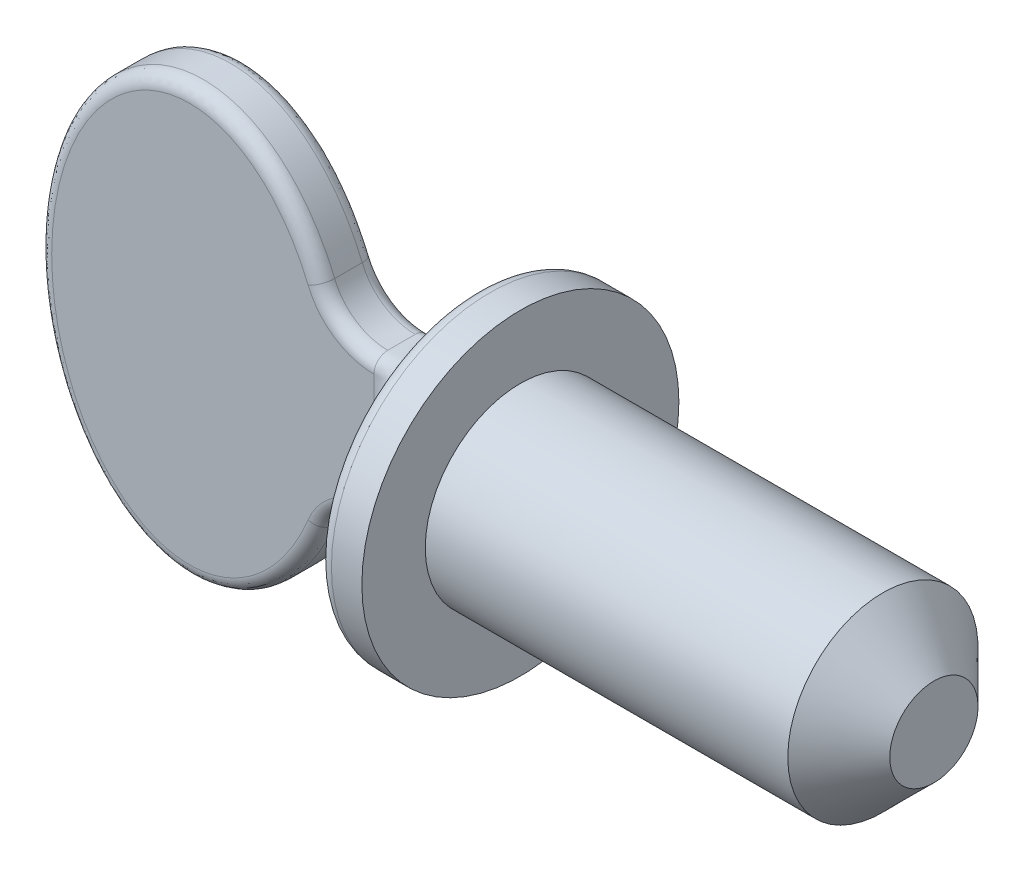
SolidWorks part; units mm, degrees
ref_plane "Front Plane" through (0, 0, 0) normal (0, 0, 1) x (1, 0, 0)
ref_plane "Top Plane" through (0, 0, 0) normal (0, 1, 0) x (1, 0, 0)
ref_plane "Right Plane" through (0, 0, 0) normal (1, 0, 0) x (0, 0, -1)
sketch "layout" plane through (0, 0, 0) normal (0, 0, 1) x (1, 0, 0)
  line L0 (0, 0) -> (13.208, 0) construction
  line L1 (5.588, 2.921) -> (5.588, -2.921)
  line L2 (3.3976, 1.3123) -> (4.8921, 1.3123) construction
  line L3 (5.588, 2.921) -> (4.7897, 2.921)
  line L4 (4.7897, 2.921) -> (4.7897, 3.2655) construction
  line L5 (4.2865, 1.706) -> (4.2865, 0)
  line L6 (4.2865, 1.706) -> (3.3355, 0.7551) construction
  line L7 (13.208, 1.7526) -> (13.208, 0)
  line L8 (3.3976, 1.3123) -> (3.3976, -1.3123)
  line L9 (13.208, 1.7526) -> (5.588, 1.7526)
  arc A0 (3.3976, 1.3123) -> (2.4197, 1.9685) centre (3.3976, 2.3692) cw
  arc A1 (4.7897, 2.921) -> (4.2865, 1.706) centre (3.0715, 2.921) cw
  arc A2 (3.3976, -1.3123) -> (2.4197, -1.9685) centre (3.3976, -2.3692) ccw
  ellipse E0 centre (0, 0) end of major axis (0, 3.937) minor radius 2.794 (2.4197, 1.9685) -> (2.4197, -1.9685) ccw
  dimension "Head Width" = 7.874
  dimension "Shoulder Dia" = 5.842
  dimension "Head Height" = 8.382
  dimension "D4" = 5.588
  dimension "D5" = 2.6247
  dimension "D6" = 3.937
  dimension "D7" = 3.4121
  dimension "D8" = 0.7983
  dimension "D9" = 45
  dimension "Length" = 7.62
  dimension "Base Screw Dia" = 3.5052
sketch "Sketch3" plane through (0, 0, 0) normal (0, 0, 1) x (1, 0, 0)
  line L0 (3.3976, 1.3123) -> (3.3976, -1.3123) construction
  line L1 (3.3976, 1.3123) -> (3.3976, -1.3123)
  arc A0 (3.3976, -1.3123) -> (2.4197, -1.9685) centre (3.3976, -2.3692) ccw construction
  arc A1 (2.4197, 1.9685) -> (3.3976, 1.3123) centre (3.3976, 2.3692) ccw construction
  arc A2 (3.3976, -1.3123) -> (2.4197, -1.9685) centre (3.3976, -2.3692) ccw
  arc A3 (2.4197, 1.9685) -> (3.3976, 1.3123) centre (3.3976, 2.3692) ccw
  ellipse E0 centre (0, 0) end of major axis (0, 3.937) minor radius 2.794 (2.4197, 1.9685) -> (2.4197, -1.9685) ccw construction
  ellipse E1 centre (0, 0) end of major axis (0, 3.937) minor radius 2.794 (2.4197, 1.9685) -> (2.4197, -1.9685) ccw
extrude "Extrude1" add sketch "Sketch3" along normal mid plane 1.016
fillet "Fillet1" radius 0.254 6 edges at (2.8088, 1.4916, -0.508) (2.8088, -1.4916, -0.508) (2.8088, 1.4916, 0.508) (2.8088, -1.4916, 0.508) (-2.794, 0, -0.508) (-2.794, 0, 0.508)
sketch "Sketch4" plane through (0, 0, 0) normal (0, 0, 1) x (1, 0, 0)
  line L0 (13.208, 1.7526) -> (13.208, 0) construction
  line L1 (13.208, 1.7526) -> (5.588, 1.7526) construction
  line L2 (5.588, 2.921) -> (5.588, -2.921) construction
  line L3 (5.588, 2.921) -> (4.7897, 2.921) construction
  line L4 (4.2865, 1.706) -> (4.2865, 0) construction
  line L5 (13.208, 0.8128) -> (13.208, 0)
  line L6 (12.2682, 1.7526) -> (5.588, 1.7526)
  line L7 (5.588, 2.921) -> (5.588, 1.7526)
  line L8 (5.588, 2.921) -> (4.7897, 2.921)
  line L9 (4.2865, 1.706) -> (4.2865, 0)
  line L10 (0, 0) -> (16.8942, 0) construction
  line L11 (13.208, 0) -> (4.2865, 0)
  line L12 (12.2682, 1.7526) -> (13.208, 0.8128)
  line L15 (12.2682, -1.7526) -> (13.208, -0.8128) construction
  arc A0 (4.2865, 1.706) -> (4.7897, 2.921) centre (3.0715, 2.921) ccw construction
  arc A1 (4.2865, 1.706) -> (4.7897, 2.921) centre (3.0715, 2.921) ccw
  dimension "O" = 1.6256
  dimension "D3" = 90
revolve "Revolve1" add sketch "Sketch4" angle 360 about L10
loft "Loft1" add
fillet "Fillet2" radius 0.254 1 edges at (4.7897, 0, 2.921)
sketch "Sketch5" plane through (0, 0, 0) normal (0, 1, 0) x (1, 0, 0)
  line L0 (11.7227, 2.2981) -> (12.2682, 2.2981)
  line L1 (12.2682, 2.2981) -> (12.2682, 1.7526)
  line L2 (12.2682, 1.7526) -> (11.9954, 1.2802)
  line L3 (11.9954, 1.2802) -> (11.7227, 1.7526)
  line L5 (11.7227, 1.7526) -> (11.7227, 2.2981)
  line L7 (-3.6147, 0) -> (14.1406, 0) construction
  dimension "D1" = 0.4724
revolve "Cut-Revolve10" [suppressed] cut sketch "Sketch5" angle 360 about L7
pattern_linear "LPattern10" [suppressed] count 8 along (1, 0, 0)
equation "\"D4@layout\" = \"Head Height@layout\" / 3 * 2"
equation "\"D5@layout\" = \"Head Width@layout\" / 3"
equation "\"D6@layout\" = \"Head Width@layout\" / 2"
equation "\"D7@layout\" = \"D5@layout\" * 1.3"
equation "\"D8@layout\" = \"D4@layout\"  / 7"
equation "\"D1@Fillet1\" = \"Head Thickness@Extrude1\" / 4"
equation "\"D1@Fillet2\" = \"D1@Fillet1\""
equation "\"D1@Sketch5\" = ( \"Base Screw Dia@layout\"- \"Minor Dia@Cosmetic Thread1\" )  / 2"
equation "\"D1@LPattern10\" = int((\"Length@layout\"-\"O@Sketch4\"/2)/\"Advance@LPattern10\")"
